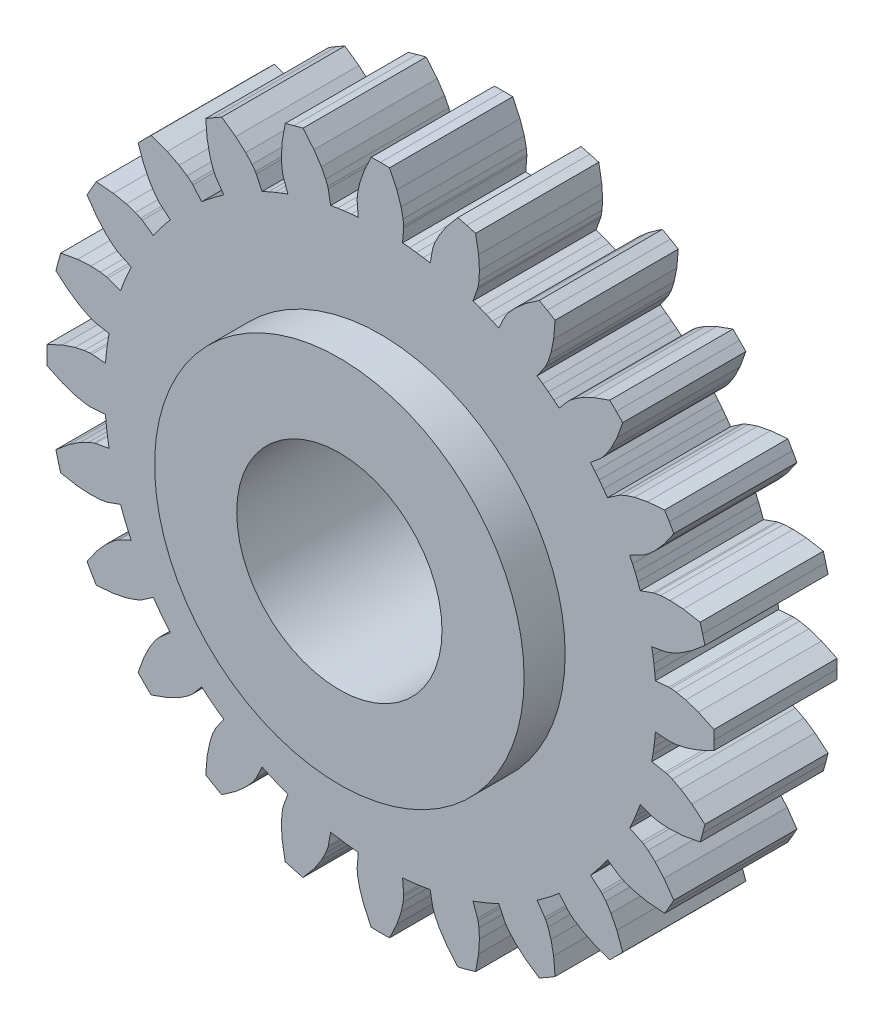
SolidWorks part; units mm, degrees
ref_plane "前视基准面" through (0, 0, 0) normal (0, 0, 1) x (1, 0, 0)
ref_plane "上视基准面" through (0, 0, 0) normal (0, 1, 0) x (1, 0, 0)
ref_plane "右视基准面" through (0, 0, 0) normal (1, 0, 0) x (0, 0, -1)
other "Configuration Table"
sketch "草图1" plane through (0, 0, 0) normal (0, 0, 1) x (1, 0, 0)
  line L0 (26.7883, -2.1572) -> (28.0998, -2.2628)
  line L1 (28.0998, -2.2628) -> (28.2853, -2.2635)
  line L2 (28.2853, -2.2635) -> (28.8389, -2.209)
  line L3 (28.8389, -2.209) -> (29.7457, -2.0155)
  line L4 (29.7457, -2.0155) -> (30.9763, -1.6023)
  line L5 (30.9763, -1.6023) -> (32.4877, -0.8943)
  line L6 (32.4877, -0.8943) -> (32.5, 0)
  line L7 (32.5, 0) -> (32.4877, 0.8943)
  line L8 (32.4877, 0.8943) -> (30.9763, 1.6023)
  line L9 (30.9763, 1.6023) -> (29.7457, 2.0155)
  line L10 (29.7457, 2.0155) -> (28.8389, 2.209)
  line L11 (28.8389, 2.209) -> (28.2853, 2.2635)
  line L12 (28.2853, 2.2635) -> (28.0998, 2.2628)
  line L13 (28.0998, 2.2628) -> (26.7883, 2.1572)
  line L14 (26.7883, 2.1572) -> (26.7252, 2.8334)
  line L15 (26.7252, 2.8334) -> (26.6451, 3.5079)
  line L16 (26.6451, 3.5079) -> (26.5479, 4.1801)
  line L17 (26.5479, 4.1801) -> (26.4338, 4.8496)
  line L18 (26.4338, 4.8496) -> (27.728, 5.0871)
  line L19 (27.728, 5.0871) -> (27.9073, 5.1344)
  line L20 (27.9073, 5.1344) -> (28.428, 5.3303)
  line L21 (28.428, 5.3303) -> (29.2538, 5.752)
  line L22 (29.2538, 5.752) -> (30.3355, 6.4696)
  line L23 (30.3355, 6.4696) -> (31.6122, 7.5446)
  line L24 (31.6122, 7.5446) -> (31.3926, 8.4116)
  line L25 (31.3926, 8.4116) -> (31.1492, 9.2723)
  line L26 (31.1492, 9.2723) -> (29.5061, 9.5649)
  line L27 (29.5061, 9.5649) -> (28.2105, 9.6456)
  line L28 (28.2105, 9.6456) -> (27.2845, 9.5978)
  line L29 (27.2845, 9.5978) -> (26.7356, 9.5072)
  line L30 (26.7356, 9.5072) -> (26.5567, 9.4585)
  line L31 (26.5567, 9.4585) -> (25.3172, 9.017)
  line L32 (25.3172, 9.017) -> (25.0812, 9.6539)
  line L33 (25.0812, 9.6539) -> (24.8293, 10.2846)
  line L34 (24.8293, 10.2846) -> (24.5614, 10.9088)
  line L35 (24.5614, 10.9088) -> (24.2779, 11.526)
  line L36 (24.2779, 11.526) -> (25.4666, 12.0903)
  line L37 (25.4666, 12.0903) -> (25.6275, 12.1824)
  line L38 (25.6275, 12.1824) -> (26.0798, 12.5064)
  line L39 (26.0798, 12.5064) -> (26.7683, 13.1274)
  line L40 (26.7683, 13.1274) -> (27.6274, 14.1005)
  line L41 (27.6274, 14.1005) -> (28.5823, 15.4693)
  line L42 (28.5823, 15.4693) -> (28.1458, 16.25)
  line L43 (28.1458, 16.25) -> (27.688, 17.0184)
  line L44 (27.688, 17.0184) -> (26.0251, 16.8758)
  line L45 (26.0251, 16.8758) -> (24.7528, 16.6183)
  line L46 (24.7528, 16.6183) -> (23.8707, 16.3325)
  line L47 (23.8707, 16.3325) -> (23.364, 16.1029)
  line L48 (23.364, 16.1029) -> (23.2037, 16.0096)
  line L49 (23.2037, 16.0096) -> (22.1207, 15.2623)
  line L50 (22.1207, 15.2623) -> (21.728, 15.8164)
  line L51 (21.728, 15.8164) -> (21.3214, 16.3605)
  line L52 (21.3214, 16.3605) -> (20.9011, 16.894)
  line L53 (20.9011, 16.894) -> (20.4675, 17.4168)
  line L54 (20.4675, 17.4168) -> (21.4696, 18.2695)
  line L55 (21.4696, 18.2695) -> (21.6013, 18.4002)
  line L56 (21.6013, 18.4002) -> (21.9542, 18.8302)
  line L57 (21.9542, 18.8302) -> (22.4586, 19.6083)
  line L58 (22.4586, 19.6083) -> (23.0365, 20.7706)
  line L59 (23.0365, 20.7706) -> (23.6047, 22.3399)
  line L60 (23.6047, 22.3399) -> (22.981, 22.981)
  line L61 (22.981, 22.981) -> (22.3399, 23.6047)
  line L62 (22.3399, 23.6047) -> (20.7706, 23.0365)
  line L63 (20.7706, 23.0365) -> (19.6083, 22.4586)
  line L64 (19.6083, 22.4586) -> (18.8302, 21.9542)
  line L65 (18.8302, 21.9542) -> (18.4002, 21.6013)
  line L66 (18.4002, 21.6013) -> (18.2695, 21.4696)
  line L67 (18.2695, 21.4696) -> (17.4168, 20.4675)
  line L68 (17.4168, 20.4675) -> (16.894, 20.9011)
  line L69 (16.894, 20.9011) -> (16.3605, 21.3214)
  line L70 (16.3605, 21.3214) -> (15.8164, 21.728)
  line L71 (15.8164, 21.728) -> (15.2623, 22.1207)
  line L72 (15.2623, 22.1207) -> (16.0096, 23.2037)
  line L73 (16.0096, 23.2037) -> (16.1029, 23.364)
  line L74 (16.1029, 23.364) -> (16.3325, 23.8707)
  line L75 (16.3325, 23.8707) -> (16.6183, 24.7528)
  line L76 (16.6183, 24.7528) -> (16.8758, 26.0251)
  line L77 (16.8758, 26.0251) -> (17.0184, 27.688)
  line L78 (17.0184, 27.688) -> (16.25, 28.1458)
  line L79 (16.25, 28.1458) -> (15.4693, 28.5823)
  line L80 (15.4693, 28.5823) -> (14.1005, 27.6274)
  line L81 (14.1005, 27.6274) -> (13.1274, 26.7683)
  line L82 (13.1274, 26.7683) -> (12.5064, 26.0798)
  line L83 (12.5064, 26.0798) -> (12.1824, 25.6275)
  line L84 (12.1824, 25.6275) -> (12.0903, 25.4666)
  line L85 (12.0903, 25.4666) -> (11.526, 24.2779)
  line L86 (11.526, 24.2779) -> (10.9088, 24.5614)
  line L87 (10.9088, 24.5614) -> (10.2846, 24.8293)
  line L88 (10.2846, 24.8293) -> (9.6539, 25.0812)
  line L89 (9.6539, 25.0812) -> (9.017, 25.3172)
  line L90 (9.017, 25.3172) -> (9.4585, 26.5567)
  line L91 (9.4585, 26.5567) -> (9.5072, 26.7356)
  line L92 (9.5072, 26.7356) -> (9.5978, 27.2845)
  line L93 (9.5978, 27.2845) -> (9.6456, 28.2105)
  line L94 (9.6456, 28.2105) -> (9.5649, 29.5061)
  line L95 (9.5649, 29.5061) -> (9.2723, 31.1492)
  line L96 (9.2723, 31.1492) -> (8.4116, 31.3926)
  line L97 (8.4116, 31.3926) -> (7.5446, 31.6122)
  line L98 (7.5446, 31.6122) -> (6.4696, 30.3355)
  line L99 (6.4696, 30.3355) -> (5.752, 29.2538)
  line L100 (5.752, 29.2538) -> (5.3303, 28.428)
  line L101 (5.3303, 28.428) -> (5.1344, 27.9073)
  line L102 (5.1344, 27.9073) -> (5.0871, 27.728)
  line L103 (5.0871, 27.728) -> (4.8496, 26.4338)
  line L104 (4.8496, 26.4338) -> (4.1801, 26.5479)
  line L105 (4.1801, 26.5479) -> (3.5079, 26.6451)
  line L106 (3.5079, 26.6451) -> (2.8334, 26.7252)
  line L107 (2.8334, 26.7252) -> (2.1572, 26.7883)
  line L108 (2.1572, 26.7883) -> (2.2628, 28.0998)
  line L109 (2.2628, 28.0998) -> (2.2635, 28.2853)
  line L110 (2.2635, 28.2853) -> (2.209, 28.8389)
  line L111 (2.209, 28.8389) -> (2.0155, 29.7457)
  line L112 (2.0155, 29.7457) -> (1.6023, 30.9763)
  line L113 (1.6023, 30.9763) -> (0.8943, 32.4877)
  line L114 (0.8943, 32.4877) -> (0, 32.5)
  line L115 (0, 32.5) -> (-0.8943, 32.4877)
  line L116 (-0.8943, 32.4877) -> (-1.6023, 30.9763)
  line L117 (-1.6023, 30.9763) -> (-2.0155, 29.7457)
  line L118 (-2.0155, 29.7457) -> (-2.209, 28.8389)
  line L119 (-2.209, 28.8389) -> (-2.2635, 28.2853)
  line L120 (-2.2635, 28.2853) -> (-2.2628, 28.0998)
  line L121 (-2.2628, 28.0998) -> (-2.1572, 26.7883)
  line L122 (-2.1572, 26.7883) -> (-2.8334, 26.7252)
  line L123 (-2.8334, 26.7252) -> (-3.5079, 26.6451)
  line L124 (-3.5079, 26.6451) -> (-4.1801, 26.5479)
  line L125 (-4.1801, 26.5479) -> (-4.8496, 26.4338)
  line L126 (-4.8496, 26.4338) -> (-5.0871, 27.728)
  line L127 (-5.0871, 27.728) -> (-5.1344, 27.9073)
  line L128 (-5.1344, 27.9073) -> (-5.3303, 28.428)
  line L129 (-5.3303, 28.428) -> (-5.752, 29.2538)
  line L130 (-5.752, 29.2538) -> (-6.4696, 30.3355)
  line L131 (-6.4696, 30.3355) -> (-7.5446, 31.6122)
  line L132 (-7.5446, 31.6122) -> (-8.4116, 31.3926)
  line L133 (-8.4116, 31.3926) -> (-9.2723, 31.1492)
  line L134 (-9.2723, 31.1492) -> (-9.5649, 29.5061)
  line L135 (-9.5649, 29.5061) -> (-9.6456, 28.2105)
  line L136 (-9.6456, 28.2105) -> (-9.5978, 27.2845)
  line L137 (-9.5978, 27.2845) -> (-9.5072, 26.7356)
  line L138 (-9.5072, 26.7356) -> (-9.4585, 26.5567)
  line L139 (-9.4585, 26.5567) -> (-9.017, 25.3172)
  line L140 (-9.017, 25.3172) -> (-9.6539, 25.0812)
  line L141 (-9.6539, 25.0812) -> (-10.2846, 24.8293)
  line L142 (-10.2846, 24.8293) -> (-10.9088, 24.5614)
  line L143 (-10.9088, 24.5614) -> (-11.526, 24.2779)
  line L144 (-11.526, 24.2779) -> (-12.0903, 25.4666)
  line L145 (-12.0903, 25.4666) -> (-12.1824, 25.6275)
  line L146 (-12.1824, 25.6275) -> (-12.5064, 26.0798)
  line L147 (-12.5064, 26.0798) -> (-13.1274, 26.7683)
  line L148 (-13.1274, 26.7683) -> (-14.1005, 27.6274)
  line L149 (-14.1005, 27.6274) -> (-15.4693, 28.5823)
  line L150 (-15.4693, 28.5823) -> (-16.25, 28.1458)
  line L151 (-16.25, 28.1458) -> (-17.0184, 27.688)
  line L152 (-17.0184, 27.688) -> (-16.8758, 26.0251)
  line L153 (-16.8758, 26.0251) -> (-16.6183, 24.7528)
  line L154 (-16.6183, 24.7528) -> (-16.3325, 23.8707)
  line L155 (-16.3325, 23.8707) -> (-16.1029, 23.364)
  line L156 (-16.1029, 23.364) -> (-16.0096, 23.2037)
  line L157 (-16.0096, 23.2037) -> (-15.2623, 22.1207)
  line L158 (-15.2623, 22.1207) -> (-15.8164, 21.728)
  line L159 (-15.8164, 21.728) -> (-16.3605, 21.3214)
  line L160 (-16.3605, 21.3214) -> (-16.894, 20.9011)
  line L161 (-16.894, 20.9011) -> (-17.4168, 20.4675)
  line L162 (-17.4168, 20.4675) -> (-18.2695, 21.4696)
  line L163 (-18.2695, 21.4696) -> (-18.4002, 21.6013)
  line L164 (-18.4002, 21.6013) -> (-18.8302, 21.9542)
  line L165 (-18.8302, 21.9542) -> (-19.6083, 22.4586)
  line L166 (-19.6083, 22.4586) -> (-20.7706, 23.0365)
  line L167 (-20.7706, 23.0365) -> (-22.3399, 23.6047)
  line L168 (-22.3399, 23.6047) -> (-22.981, 22.981)
  line L169 (-22.981, 22.981) -> (-23.6047, 22.3399)
  line L170 (-23.6047, 22.3399) -> (-23.0365, 20.7706)
  line L171 (-23.0365, 20.7706) -> (-22.4586, 19.6083)
  line L172 (-22.4586, 19.6083) -> (-21.9542, 18.8302)
  line L173 (-21.9542, 18.8302) -> (-21.6013, 18.4002)
  line L174 (-21.6013, 18.4002) -> (-21.4696, 18.2695)
  line L175 (-21.4696, 18.2695) -> (-20.4675, 17.4168)
  line L176 (-20.4675, 17.4168) -> (-20.9011, 16.894)
  line L177 (-20.9011, 16.894) -> (-21.3214, 16.3605)
  line L178 (-21.3214, 16.3605) -> (-21.728, 15.8164)
  line L179 (-21.728, 15.8164) -> (-22.1207, 15.2623)
  line L180 (-22.1207, 15.2623) -> (-23.2037, 16.0096)
  line L181 (-23.2037, 16.0096) -> (-23.364, 16.1029)
  line L182 (-23.364, 16.1029) -> (-23.8707, 16.3325)
  line L183 (-23.8707, 16.3325) -> (-24.7528, 16.6183)
  line L184 (-24.7528, 16.6183) -> (-26.0251, 16.8758)
  line L185 (-26.0251, 16.8758) -> (-27.688, 17.0184)
  line L186 (-27.688, 17.0184) -> (-28.1458, 16.25)
  line L187 (-28.1458, 16.25) -> (-28.5823, 15.4693)
  line L188 (-28.5823, 15.4693) -> (-27.6274, 14.1005)
  line L189 (-27.6274, 14.1005) -> (-26.7683, 13.1274)
  line L190 (-26.7683, 13.1274) -> (-26.0798, 12.5064)
  line L191 (-26.0798, 12.5064) -> (-25.6275, 12.1824)
  line L192 (-25.6275, 12.1824) -> (-25.4666, 12.0903)
  line L193 (-25.4666, 12.0903) -> (-24.2779, 11.526)
  line L194 (-24.2779, 11.526) -> (-24.5614, 10.9088)
  line L195 (-24.5614, 10.9088) -> (-24.8293, 10.2846)
  line L196 (-24.8293, 10.2846) -> (-25.0812, 9.6539)
  line L197 (-25.0812, 9.6539) -> (-25.3172, 9.017)
  line L198 (-25.3172, 9.017) -> (-26.5567, 9.4585)
  line L199 (-26.5567, 9.4585) -> (-26.7356, 9.5072)
  line L200 (-26.7356, 9.5072) -> (-27.2845, 9.5978)
  line L201 (-27.2845, 9.5978) -> (-28.2105, 9.6456)
  line L202 (-28.2105, 9.6456) -> (-29.5061, 9.5649)
  line L203 (-29.5061, 9.5649) -> (-31.1492, 9.2723)
  line L204 (-31.1492, 9.2723) -> (-31.3926, 8.4116)
  line L205 (-31.3926, 8.4116) -> (-31.6122, 7.5446)
  line L206 (-31.6122, 7.5446) -> (-30.3355, 6.4696)
  line L207 (-30.3355, 6.4696) -> (-29.2538, 5.752)
  line L208 (-29.2538, 5.752) -> (-28.428, 5.3303)
  line L209 (-28.428, 5.3303) -> (-27.9073, 5.1344)
  line L210 (-27.9073, 5.1344) -> (-27.728, 5.0871)
  line L211 (-27.728, 5.0871) -> (-26.4338, 4.8496)
  line L212 (-26.4338, 4.8496) -> (-26.5479, 4.1801)
  line L213 (-26.5479, 4.1801) -> (-26.6451, 3.5079)
  line L214 (-26.6451, 3.5079) -> (-26.7252, 2.8334)
  line L215 (-26.7252, 2.8334) -> (-26.7883, 2.1572)
  line L216 (-26.7883, 2.1572) -> (-28.0998, 2.2628)
  line L217 (-28.0998, 2.2628) -> (-28.2853, 2.2635)
  line L218 (-28.2853, 2.2635) -> (-28.8389, 2.209)
  line L219 (-28.8389, 2.209) -> (-29.7457, 2.0155)
  line L220 (-29.7457, 2.0155) -> (-30.9763, 1.6023)
  line L221 (-30.9763, 1.6023) -> (-32.4877, 0.8943)
  line L222 (-32.4877, 0.8943) -> (-32.5, 0)
  line L223 (-32.5, 0) -> (-32.4877, -0.8943)
  line L224 (-32.4877, -0.8943) -> (-30.9763, -1.6023)
  line L225 (-30.9763, -1.6023) -> (-29.7457, -2.0155)
  line L226 (-29.7457, -2.0155) -> (-28.8389, -2.209)
  line L227 (-28.8389, -2.209) -> (-28.2853, -2.2635)
  line L228 (-28.2853, -2.2635) -> (-28.0998, -2.2628)
  line L229 (-28.0998, -2.2628) -> (-26.7883, -2.1572)
  line L230 (-26.7883, -2.1572) -> (-26.7252, -2.8334)
  line L231 (-26.7252, -2.8334) -> (-26.6451, -3.5079)
  line L232 (-26.6451, -3.5079) -> (-26.5479, -4.1801)
  line L233 (-26.5479, -4.1801) -> (-26.4338, -4.8496)
  line L234 (-26.4338, -4.8496) -> (-27.728, -5.0871)
  line L235 (-27.728, -5.0871) -> (-27.9073, -5.1344)
  line L236 (-27.9073, -5.1344) -> (-28.428, -5.3303)
  line L237 (-28.428, -5.3303) -> (-29.2538, -5.752)
  line L238 (-29.2538, -5.752) -> (-30.3355, -6.4696)
  line L239 (-30.3355, -6.4696) -> (-31.6122, -7.5446)
  line L240 (-31.6122, -7.5446) -> (-31.3926, -8.4116)
  line L241 (-31.3926, -8.4116) -> (-31.1492, -9.2723)
  line L242 (-31.1492, -9.2723) -> (-29.5061, -9.5649)
  line L243 (-29.5061, -9.5649) -> (-28.2105, -9.6456)
  line L244 (-28.2105, -9.6456) -> (-27.2845, -9.5978)
  line L245 (-27.2845, -9.5978) -> (-26.7356, -9.5072)
  line L246 (-26.7356, -9.5072) -> (-26.5567, -9.4585)
  line L247 (-26.5567, -9.4585) -> (-25.3172, -9.017)
  line L248 (-25.3172, -9.017) -> (-25.0812, -9.6539)
  line L249 (-25.0812, -9.6539) -> (-24.8293, -10.2846)
  line L250 (-24.8293, -10.2846) -> (-24.5614, -10.9088)
  line L251 (-24.5614, -10.9088) -> (-24.2779, -11.526)
  line L252 (-24.2779, -11.526) -> (-25.4666, -12.0903)
  line L253 (-25.4666, -12.0903) -> (-25.6275, -12.1824)
  line L254 (-25.6275, -12.1824) -> (-26.0798, -12.5064)
  line L255 (-26.0798, -12.5064) -> (-26.7683, -13.1274)
  line L256 (-26.7683, -13.1274) -> (-27.6274, -14.1005)
  line L257 (-27.6274, -14.1005) -> (-28.5823, -15.4693)
  line L258 (-28.5823, -15.4693) -> (-28.1458, -16.25)
  line L259 (-28.1458, -16.25) -> (-27.688, -17.0184)
  line L260 (-27.688, -17.0184) -> (-26.0251, -16.8758)
  line L261 (-26.0251, -16.8758) -> (-24.7528, -16.6183)
  line L262 (-24.7528, -16.6183) -> (-23.8707, -16.3325)
  line L263 (-23.8707, -16.3325) -> (-23.364, -16.1029)
  line L264 (-23.364, -16.1029) -> (-23.2037, -16.0096)
  line L265 (-23.2037, -16.0096) -> (-22.1207, -15.2623)
  line L266 (-22.1207, -15.2623) -> (-21.728, -15.8164)
  line L267 (-21.728, -15.8164) -> (-21.3214, -16.3605)
  line L268 (-21.3214, -16.3605) -> (-20.9011, -16.894)
  line L269 (-20.9011, -16.894) -> (-20.4675, -17.4168)
  line L270 (-20.4675, -17.4168) -> (-21.4696, -18.2695)
  line L271 (-21.4696, -18.2695) -> (-21.6013, -18.4002)
  line L272 (-21.6013, -18.4002) -> (-21.9542, -18.8302)
  line L273 (-21.9542, -18.8302) -> (-22.4586, -19.6083)
  line L274 (-22.4586, -19.6083) -> (-23.0365, -20.7706)
  line L275 (-23.0365, -20.7706) -> (-23.6047, -22.3399)
  line L276 (-23.6047, -22.3399) -> (-22.981, -22.981)
  line L277 (-22.981, -22.981) -> (-22.3399, -23.6047)
  line L278 (-22.3399, -23.6047) -> (-20.7706, -23.0365)
  line L279 (-20.7706, -23.0365) -> (-19.6083, -22.4586)
  line L280 (-19.6083, -22.4586) -> (-18.8302, -21.9542)
  line L281 (-18.8302, -21.9542) -> (-18.4002, -21.6013)
  line L282 (-18.4002, -21.6013) -> (-18.2695, -21.4696)
  line L283 (-18.2695, -21.4696) -> (-17.4168, -20.4675)
  line L284 (-17.4168, -20.4675) -> (-16.894, -20.9011)
  line L285 (-16.894, -20.9011) -> (-16.3605, -21.3214)
  line L286 (-16.3605, -21.3214) -> (-15.8164, -21.728)
  line L287 (-15.8164, -21.728) -> (-15.2623, -22.1207)
  line L288 (-15.2623, -22.1207) -> (-16.0096, -23.2037)
  line L289 (-16.0096, -23.2037) -> (-16.1029, -23.364)
  line L290 (-16.1029, -23.364) -> (-16.3325, -23.8707)
  line L291 (-16.3325, -23.8707) -> (-16.6183, -24.7528)
  line L292 (-16.6183, -24.7528) -> (-16.8758, -26.0251)
  line L293 (-16.8758, -26.0251) -> (-17.0184, -27.688)
  line L294 (-17.0184, -27.688) -> (-16.25, -28.1458)
  line L295 (-16.25, -28.1458) -> (-15.4693, -28.5823)
  line L296 (-15.4693, -28.5823) -> (-14.1005, -27.6274)
  line L297 (-14.1005, -27.6274) -> (-13.1274, -26.7683)
  line L298 (-13.1274, -26.7683) -> (-12.5064, -26.0798)
  line L299 (-12.5064, -26.0798) -> (-12.1824, -25.6275)
  line L300 (-12.1824, -25.6275) -> (-12.0903, -25.4666)
  line L301 (-12.0903, -25.4666) -> (-11.526, -24.2779)
  line L302 (-11.526, -24.2779) -> (-10.9088, -24.5614)
  line L303 (-10.9088, -24.5614) -> (-10.2846, -24.8293)
  line L304 (-10.2846, -24.8293) -> (-9.6539, -25.0812)
  line L305 (-9.6539, -25.0812) -> (-9.017, -25.3172)
  line L306 (-9.017, -25.3172) -> (-9.4585, -26.5567)
  line L307 (-9.4585, -26.5567) -> (-9.5072, -26.7356)
  line L308 (-9.5072, -26.7356) -> (-9.5978, -27.2845)
  line L309 (-9.5978, -27.2845) -> (-9.6456, -28.2105)
  line L310 (-9.6456, -28.2105) -> (-9.5649, -29.5061)
  line L311 (-9.5649, -29.5061) -> (-9.2723, -31.1492)
  line L312 (-9.2723, -31.1492) -> (-8.4116, -31.3926)
  line L313 (-8.4116, -31.3926) -> (-7.5446, -31.6122)
  line L314 (-7.5446, -31.6122) -> (-6.4696, -30.3355)
  line L315 (-6.4696, -30.3355) -> (-5.752, -29.2538)
  line L316 (-5.752, -29.2538) -> (-5.3303, -28.428)
  line L317 (-5.3303, -28.428) -> (-5.1344, -27.9073)
  line L318 (-5.1344, -27.9073) -> (-5.0871, -27.728)
  line L319 (-5.0871, -27.728) -> (-4.8496, -26.4338)
  line L320 (-4.8496, -26.4338) -> (-4.1801, -26.5479)
  line L321 (-4.1801, -26.5479) -> (-3.5079, -26.6451)
  line L322 (-3.5079, -26.6451) -> (-2.8334, -26.7252)
  line L323 (-2.8334, -26.7252) -> (-2.1572, -26.7883)
  line L324 (-2.1572, -26.7883) -> (-2.2628, -28.0998)
  line L325 (-2.2628, -28.0998) -> (-2.2635, -28.2853)
  line L326 (-2.2635, -28.2853) -> (-2.209, -28.8389)
  line L327 (-2.209, -28.8389) -> (-2.0155, -29.7457)
  line L328 (-2.0155, -29.7457) -> (-1.6023, -30.9763)
  line L329 (-1.6023, -30.9763) -> (-0.8943, -32.4877)
  line L330 (-0.8943, -32.4877) -> (0, -32.5)
  line L331 (0, -32.5) -> (0.8943, -32.4877)
  line L332 (0.8943, -32.4877) -> (1.6023, -30.9763)
  line L333 (1.6023, -30.9763) -> (2.0155, -29.7457)
  line L334 (2.0155, -29.7457) -> (2.209, -28.8389)
  line L335 (2.209, -28.8389) -> (2.2635, -28.2853)
  line L336 (2.2635, -28.2853) -> (2.2628, -28.0998)
  line L337 (2.2628, -28.0998) -> (2.1572, -26.7883)
  line L338 (2.1572, -26.7883) -> (2.8334, -26.7252)
  line L339 (2.8334, -26.7252) -> (3.5079, -26.6451)
  line L340 (3.5079, -26.6451) -> (4.1801, -26.5479)
  line L341 (4.1801, -26.5479) -> (4.8496, -26.4338)
  line L342 (4.8496, -26.4338) -> (5.0871, -27.728)
  line L343 (5.0871, -27.728) -> (5.1344, -27.9073)
  line L344 (5.1344, -27.9073) -> (5.3303, -28.428)
  line L345 (5.3303, -28.428) -> (5.752, -29.2538)
  line L346 (5.752, -29.2538) -> (6.4696, -30.3355)
  line L347 (6.4696, -30.3355) -> (7.5446, -31.6122)
  line L348 (7.5446, -31.6122) -> (8.4116, -31.3926)
  line L349 (8.4116, -31.3926) -> (9.2723, -31.1492)
  line L350 (9.2723, -31.1492) -> (9.5649, -29.5061)
  line L351 (9.5649, -29.5061) -> (9.6456, -28.2105)
  line L352 (9.6456, -28.2105) -> (9.5978, -27.2845)
  line L353 (9.5978, -27.2845) -> (9.5072, -26.7356)
  line L354 (9.5072, -26.7356) -> (9.4585, -26.5567)
  line L355 (9.4585, -26.5567) -> (9.017, -25.3172)
  line L356 (9.017, -25.3172) -> (9.6539, -25.0812)
  line L357 (9.6539, -25.0812) -> (10.2846, -24.8293)
  line L358 (10.2846, -24.8293) -> (10.9088, -24.5614)
  line L359 (10.9088, -24.5614) -> (11.526, -24.2779)
  line L360 (11.526, -24.2779) -> (12.0903, -25.4666)
  line L361 (12.0903, -25.4666) -> (12.1824, -25.6275)
  line L362 (12.1824, -25.6275) -> (12.5064, -26.0798)
  line L363 (12.5064, -26.0798) -> (13.1274, -26.7683)
  line L364 (13.1274, -26.7683) -> (14.1005, -27.6274)
  line L365 (14.1005, -27.6274) -> (15.4693, -28.5823)
  line L366 (15.4693, -28.5823) -> (16.25, -28.1458)
  line L367 (16.25, -28.1458) -> (17.0184, -27.688)
  line L368 (17.0184, -27.688) -> (16.8758, -26.0251)
  line L369 (16.8758, -26.0251) -> (16.6183, -24.7528)
  line L370 (16.6183, -24.7528) -> (16.3325, -23.8707)
  line L371 (16.3325, -23.8707) -> (16.1029, -23.364)
  line L372 (16.1029, -23.364) -> (16.0096, -23.2037)
  line L373 (16.0096, -23.2037) -> (15.2623, -22.1207)
  line L374 (15.2623, -22.1207) -> (15.8164, -21.728)
  line L375 (15.8164, -21.728) -> (16.3605, -21.3214)
  line L376 (16.3605, -21.3214) -> (16.894, -20.9011)
  line L377 (16.894, -20.9011) -> (17.4168, -20.4675)
  line L378 (17.4168, -20.4675) -> (18.2695, -21.4696)
  line L379 (18.2695, -21.4696) -> (18.4002, -21.6013)
  line L380 (18.4002, -21.6013) -> (18.8302, -21.9542)
  line L381 (18.8302, -21.9542) -> (19.6083, -22.4586)
  line L382 (19.6083, -22.4586) -> (20.7706, -23.0365)
  line L383 (20.7706, -23.0365) -> (22.3399, -23.6047)
  line L384 (22.3399, -23.6047) -> (22.981, -22.981)
  line L385 (22.981, -22.981) -> (23.6047, -22.3399)
  line L386 (23.6047, -22.3399) -> (23.0365, -20.7706)
  line L387 (23.0365, -20.7706) -> (22.4586, -19.6083)
  line L388 (22.4586, -19.6083) -> (21.9542, -18.8302)
  line L389 (21.9542, -18.8302) -> (21.6013, -18.4002)
  line L390 (21.6013, -18.4002) -> (21.4696, -18.2695)
  line L391 (21.4696, -18.2695) -> (20.4675, -17.4168)
  line L392 (20.4675, -17.4168) -> (20.9011, -16.894)
  line L393 (20.9011, -16.894) -> (21.3214, -16.3605)
  line L394 (21.3214, -16.3605) -> (21.728, -15.8164)
  line L395 (21.728, -15.8164) -> (22.1207, -15.2623)
  line L396 (22.1207, -15.2623) -> (23.2037, -16.0096)
  line L397 (23.2037, -16.0096) -> (23.364, -16.1029)
  line L398 (23.364, -16.1029) -> (23.8707, -16.3325)
  line L399 (23.8707, -16.3325) -> (24.7528, -16.6183)
  line L400 (24.7528, -16.6183) -> (26.0251, -16.8758)
  line L401 (26.0251, -16.8758) -> (27.688, -17.0184)
  line L402 (27.688, -17.0184) -> (28.1458, -16.25)
  line L403 (28.1458, -16.25) -> (28.5823, -15.4693)
  line L404 (28.5823, -15.4693) -> (27.6274, -14.1005)
  line L405 (27.6274, -14.1005) -> (26.7683, -13.1274)
  line L406 (26.7683, -13.1274) -> (26.0798, -12.5064)
  line L407 (26.0798, -12.5064) -> (25.6275, -12.1824)
  line L408 (25.6275, -12.1824) -> (25.4666, -12.0903)
  line L409 (25.4666, -12.0903) -> (24.2779, -11.526)
  line L410 (24.2779, -11.526) -> (24.5614, -10.9088)
  line L411 (24.5614, -10.9088) -> (24.8293, -10.2846)
  line L412 (24.8293, -10.2846) -> (25.0812, -9.6539)
  line L413 (25.0812, -9.6539) -> (25.3172, -9.017)
  line L414 (25.3172, -9.017) -> (26.5567, -9.4585)
  line L415 (26.5567, -9.4585) -> (26.7356, -9.5072)
  line L416 (26.7356, -9.5072) -> (27.2845, -9.5978)
  line L417 (27.2845, -9.5978) -> (28.2105, -9.6456)
  line L418 (28.2105, -9.6456) -> (29.5061, -9.5649)
  line L419 (29.5061, -9.5649) -> (31.1492, -9.2723)
  line L420 (31.1492, -9.2723) -> (31.3926, -8.4116)
  line L421 (31.3926, -8.4116) -> (31.6122, -7.5446)
  line L422 (31.6122, -7.5446) -> (30.3355, -6.4696)
  line L423 (30.3355, -6.4696) -> (29.2538, -5.752)
  line L424 (29.2538, -5.752) -> (28.428, -5.3303)
  line L425 (28.428, -5.3303) -> (27.9073, -5.1344)
  line L426 (27.9073, -5.1344) -> (27.728, -5.0871)
  line L427 (27.728, -5.0871) -> (26.4338, -4.8496)
  line L428 (26.4338, -4.8496) -> (26.5479, -4.1801)
  line L429 (26.5479, -4.1801) -> (26.6451, -3.5079)
  line L430 (26.6451, -3.5079) -> (26.7252, -2.8334)
  line L431 (26.7252, -2.8334) -> (26.7883, -2.1572)
  circle A0 centre (0, 0) radius 10
extrude "01_GEAR_BODY_Z24_M2.5_PA20" add sketch "草图1" against normal mid plane 12
sketch "草图2" plane through (0, 0, 0) normal (0, 0, 1) x (1, 0, 0)
  circle A0 centre (0, 0) radius 18
  circle A1 centre (0, 0) radius 10
  dimension "D1" = 20
  dimension "D2" = 36
extrude "02_HUB_D36_BORE_D20" add sketch "草图2" against normal mid plane 20
